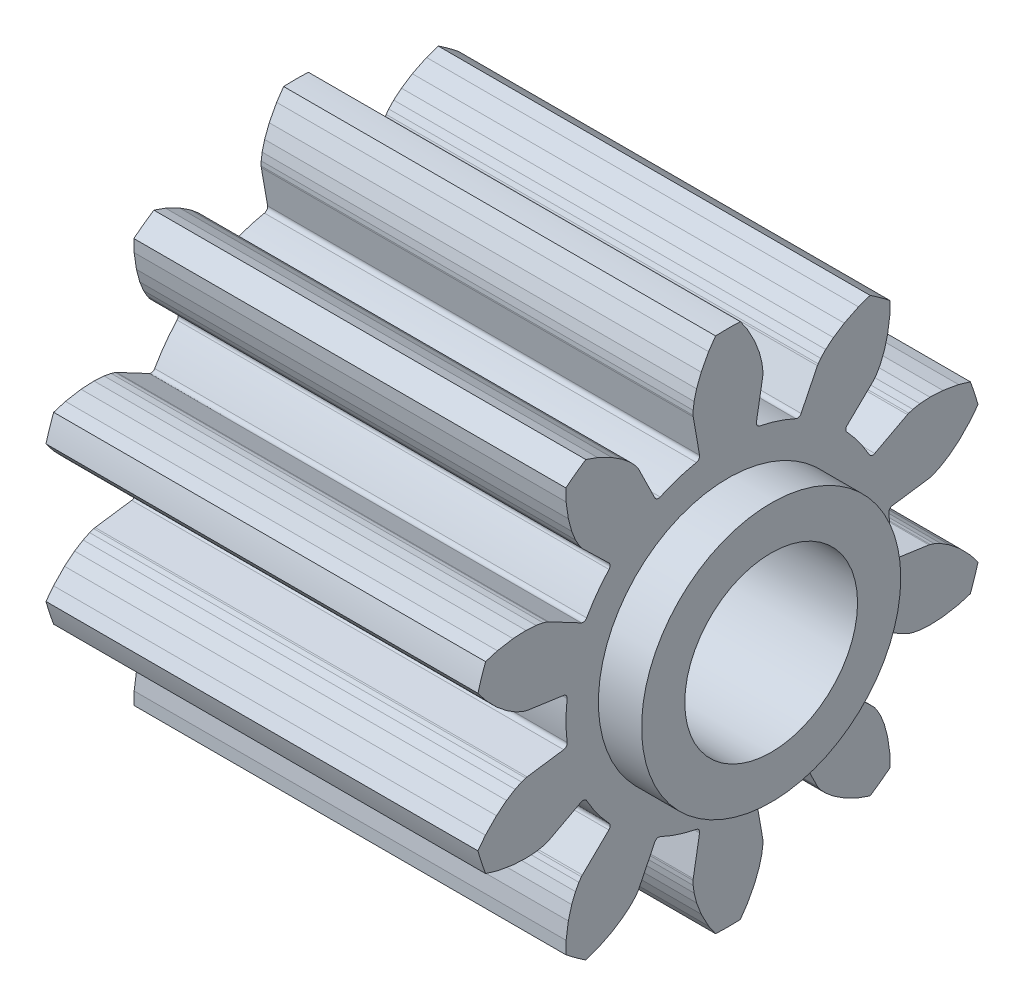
SolidWorks part; units mm, degrees
ref_plane "Plan de face" through (0, 0, 0) normal (0, 0, 1) x (1, 0, 0)
ref_plane "Plan de dessus" through (0, 0, 0) normal (0, 1, 0) x (1, 0, 0)
ref_plane "Plan de droite" through (0, 0, 0) normal (1, 0, 0) x (0, 0, -1)
imported_body "Importée1"
sketch "Esquisse1" plane through (5, 0, 0) normal (1, 0, 0) x (0, 0, -1)
  circle A0 centre (0, 0) radius 1
  circle A1 centre (0, 0) radius 1.5
  dimension "D1" = 3
extrude "Boss.-Extru.1" add sketch "Esquisse1" along normal blind 0.5
